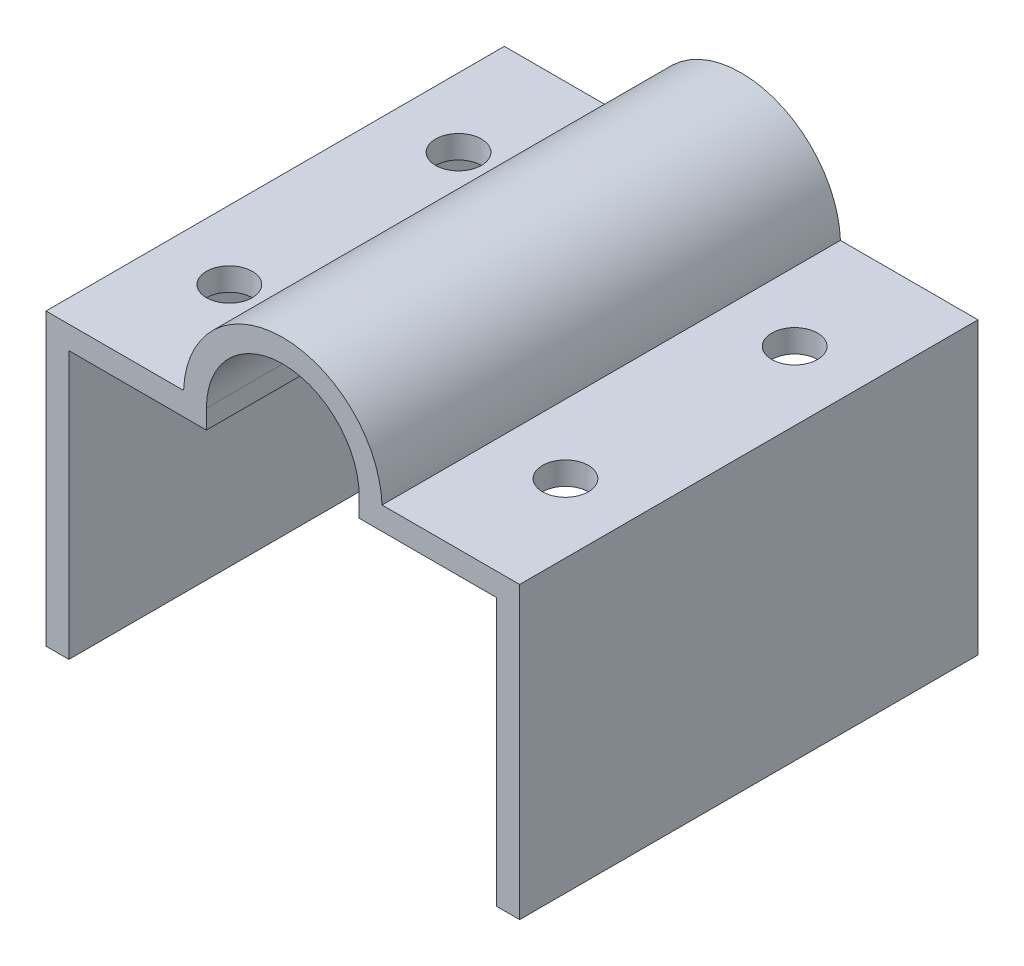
SolidWorks part; units mm, degrees
ref_plane "Plan de face" through (0, 0, 0) normal (0, 0, 1) x (1, 0, 0)
ref_plane "Plan de dessus" through (0, 0, 0) normal (0, 1, 0) x (1, 0, 0)
ref_plane "Plan de droite" through (0, 0, 0) normal (1, 0, 0) x (0, 0, -1)
sketch "Esquisse1" plane through (0, 0, 0) normal (0, 0, 1) x (1, 0, 0)
  line L0 (-28, 0) -> (-28, 35)
  line L1 (0, 0) -> (-190, 0) construction
  line L2 (-28, 35) -> (-10, 35)
  line L3 (10, 35) -> (28, 35)
  line L4 (28, 35) -> (28, 0)
  line L5 (28, 0) -> (31, 0)
  line L6 (31, 0) -> (31, 38)
  line L7 (31, 38) -> (12.9904, 38)
  line L8 (10, 35) -> (10, 37.5)
  line L9 (-28, 0) -> (-31, 0)
  line L10 (-31, 0) -> (-31, 38)
  line L11 (-190, 0) -> (-33.9984, 0) construction
  line L12 (-28, 35) -> (-28, 15) construction
  line L13 (-12.9904, 38) -> (-31, 38)
  line L14 (-10, 35) -> (-10, 37.5)
  arc A0 (10, 37.5) -> (-10, 37.5) centre (0, 37.5) ccw
  arc A1 (-9.6825, 35) -> (9.6825, 35) centre (0, 37.5) ccw construction
  arc A2 (12.9904, 38) -> (-12.9904, 38) centre (0, 37.5) ccw
  dimension "D2" = 3
  dimension "D1" = 3
  dimension "D3" = 3
extrude "Extrusion1" add sketch "Esquisse1" along normal mid plane 60
hole_wizard "Dégagement M61" positions "Esquisse3" profile "Esquisse2" hole size "M6" standard "ISO"
sketch "Esquisse3" plane through (0, 38, 0) normal (0, 1, 0) x (-1, 0, 0)
  point P1 (22, 15)
  point P2 (22, -15)
  point P4 (-22, -15)
  point P6 (-22, 15)
sketch "Esquisse2" plane through (-22, 38, 15) normal (1, 0, 0) x (0, 0, 1)
  line L0 (0, 0) -> (0, 3)
  line L1 (0, 3) -> (3, 3)
  line L2 (3, 3) -> (3, 0)
  line L5 (3, 0) -> (0, 0)
  line L11 (0, -6.35) -> (0, 107.95) construction
  dimension "Diamètre du perçage jusqu'au prochain" = 6
  dimension "Profondeur du perçage jusqu'au prochain" = 3
